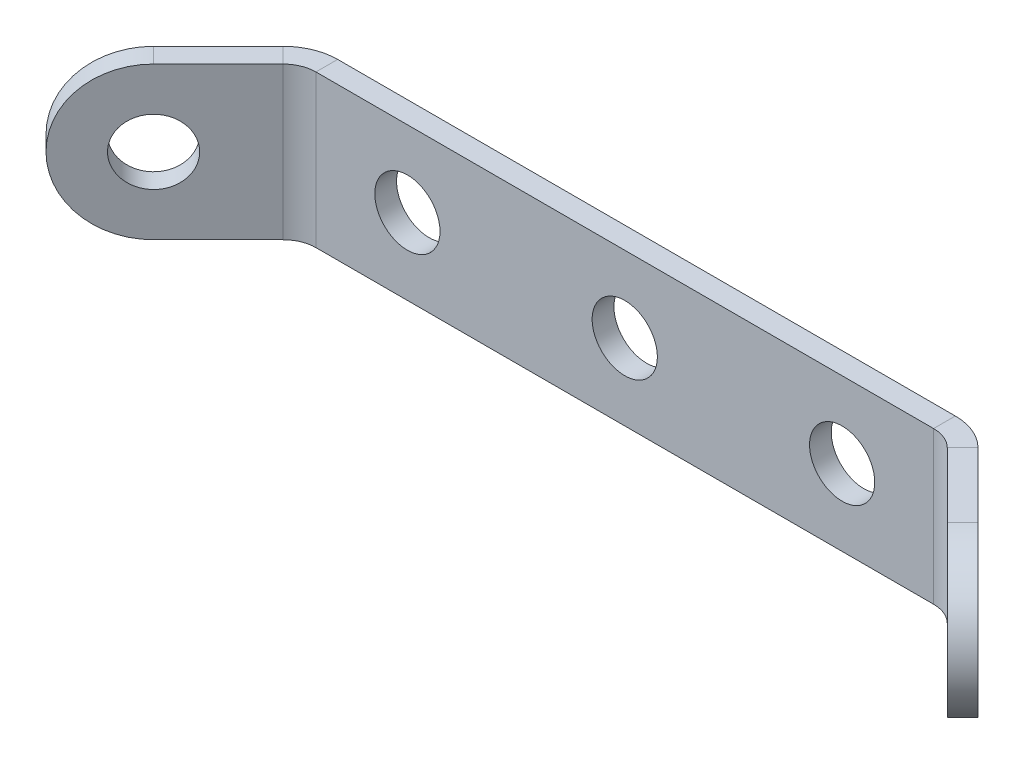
SolidWorks part; units mm, degrees
ref_plane "Front" through (0, 0, 0) normal (0, 0, 1) x (1, 0, 0)
ref_plane "Top" through (0, 0, 0) normal (0, 1, 0) x (1, 0, 0)
ref_plane "Right" through (0, 0, 0) normal (1, 0, 0) x (0, 0, -1)
sketch "Esquisse1" plane through (0, 0, 0) normal (0, 0, 1) x (1, 0, 0)
  line L0 (-20, 0) -> (20, 0) construction
  line L1 (-20, 3.5) -> (20, 3.5)
  line L2 (-20, -3.5) -> (20, -3.5)
  line L3 (-15, 3.5) -> (-15, -3.5) construction
  line L4 (15, 3.5) -> (15, -3.5) construction
  arc A0 (-20, 3.5) -> (-20, -3.5) centre (-20, 0) ccw
  arc A1 (20, -3.5) -> (20, 3.5) centre (20, 0) ccw
  circle A2 centre (0, 0) radius 1.5
  circle A3 centre (10, 0) radius 1.5
  circle A4 centre (-10, 0) radius 1.5
  circle A5 centre (-20, 0) radius 1.5
  circle A6 centre (20, 0) radius 1.5
  point P2 (0, 0)
  dimension "D6" = 3
  dimension "D1" = 30
  dimension "D2" = 10
  dimension "D3" = 10
  dimension "D4" = 10
  dimension "D5" = 15
  dimension "D7" = 7
base flange "Tôle de base pliée1" sketch "Esquisse1" thickness 1 reverse thickness direction no parameters "D1"=1.5189
sketch "Esquisse6" plane through (0, 0, 0) normal (0, 0, 1) x (1, 0, 0)
  line L0 (-15, 3.5) -> (-15, -3.5)
  line L1 (20, 3.5) -> (-20, 3.5) construction
  line L2 (-20, -3.5) -> (20, -3.5) construction
  line L3 (-20, 0) -> (-10, 0) construction
  line L4 (0, 0) -> (0, 7.4458) construction
  line L5 (15, 3.5) -> (15, -3.5)
  point P10 (-15, 0)
sketched bend "Pli esquissé1" thickness 1 parameters "D1"=0
bend "Pli esquissé2" bend radius 1.5189 bend angle 45 parameters "D5"=1
bend "Pli esquissé3" bend radius 0 bend angle 45 parameters "D5"=2
sketch "Lignes de pliage1" [suppressed] plane through (0, 0, 0) normal (0, 1, 0) x (1, 0, 0)
sketch "Cube de visualisation1" [suppressed] plane through (0, 0, 0) normal (0, 1, 0) x (1, 0, 0)
sheet metal parameters "Tôlerie1" thickness 1 parameters "D1"=1.5189
flat pattern "Etat déplié1"
sketch "Lignes de pliage2" plane through (0, 0, 0) normal (0, 0, 1) x (1, 0, 0)
  line L0 (15, -3.5) -> (15, 3.5) construction
  line L1 (-15, 3.5) -> (-15, -3.5) construction
  line L2 (15, -3.5) -> (15, 3.5) construction
  line L3 (-15, 3.5) -> (-15, -3.5) construction
sketch3d "Cube de visualisation2" [suppressed]
  line L0 (-3.5, -3.5, 0) -> (43.5, -3.5, 0) construction
  line L1 (-3.5, 3.5, 0) -> (43.5, 3.5, 0) construction
  line L2 (-3.5, -3.5, 0) -> (-3.5, 3.5, 0) construction
  line L3 (43.5, -3.5, 0) -> (43.5, 3.5, 0) construction
bend of the flat pattern "Dépliage-<Pli esquissé2>1"
bend of the flat pattern "Dépliage-<Pli esquissé3>1"
